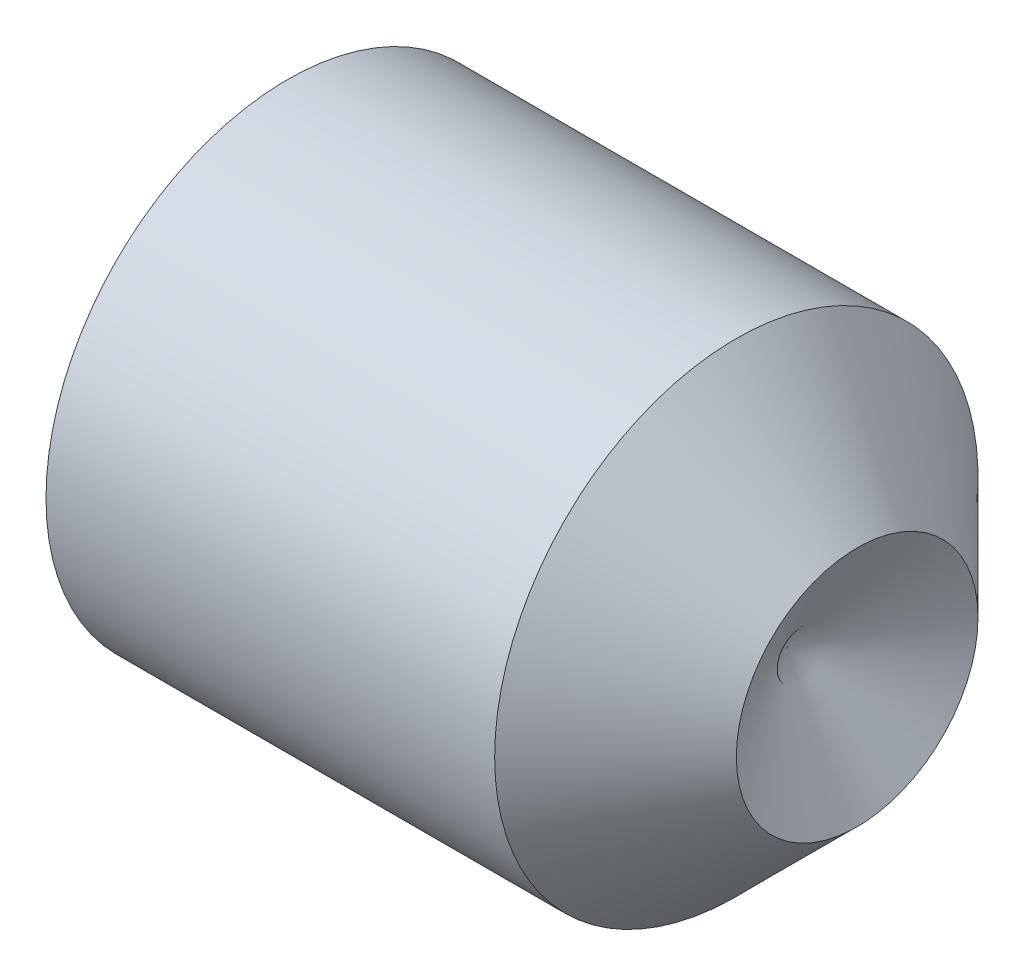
SolidWorks part; units mm, degrees
ref_plane "Front Plane" through (0, 0, 0) normal (0, 0, 1) x (1, 0, 0)
ref_plane "Top Plane" through (0, 0, 0) normal (0, 1, 0) x (1, 0, 0)
ref_plane "Right Plane" through (0, 0, 0) normal (1, 0, 0) x (0, 0, -1)
sketch "BodySke" plane through (0, 0, 0) normal (0, 0, 1) x (1, 0, 0)
  line L0 (0, 0) -> (3.28, 0) construction
  line L1 (2, 0) -> (2, 0.4)
  line L2 (2, 0.4) -> (1.6, 0.8)
  line L3 (1.6, 0.8) -> (0, 0.8)
  line L4 (0, 0.8) -> (0, 0)
  line L5 (0, 0) -> (2, 0)
  line L6 (1.65, 1.0236) -> (1.65, -0.6432) construction
  point P5 (0, 0.601)
  dimension "Diameter" = 1.6
  dimension "Length" = 2
  dimension "Chamfer_End" = 0.8
  dimension "Angle" = 135
  dimension "Minor_dia" = 1.202
  dimension "Advance" = 0.35
revolve "BaseBody" add sketch "BodySke" angle 360 about L0
sketch "HeadChamferSke" plane through (0, 0, 0) normal (0, 0, 1) x (1, 0, 0)
  line L0 (0, 0) -> (2.4505, 0) construction
  line L1 (0, 0.8) -> (0, 0.601)
  line L2 (0, 0.8) -> (0.1149, 0.8)
  line L3 (0.1149, 0.8) -> (0, 0.601)
  line L4 (1.6, 0.8) -> (0, 0.8) construction
  line L5 (0, 0.8) -> (0, -0.8) construction
  line L6 (0, 0.8) -> (0, 0) construction
  dimension "Angle" = 30
revolve "HeadChamfer" cut sketch "HeadChamferSke" angle 360 about L0
sketch "HexagonSocketSke" plane through (0, 0, 0) normal (-1, 0, 0) x (0, 0, 1)
  line L1 (0, 0.4041) -> (-0.35, 0.2021)
  line L2 (-0.35, 0.2021) -> (-0.35, -0.2021)
  line L3 (-0.35, -0.2021) -> (0, -0.4041)
  line L4 (0, -0.4041) -> (0.35, -0.2021)
  line L5 (0.35, -0.2021) -> (0.35, 0.2021)
  line L6 (0.35, 0.2021) -> (0, 0.4041)
  circle A0 centre (0, 0) radius 0.35 construction
  dimension "Hexagon_Width" = 0.7
extrude "HexagonSocket" cut sketch "HexagonSocketSke" against normal blind 0.7
sketch "CupPointSke" plane through (0, 0, 0) normal (0, 0, 1) x (1, 0, 0)
  line L0 (0, 0) -> (2.5104, 0) construction
  line L1 (2, 0.4) -> (2, 0)
  line L2 (2, 0) -> (1.7691, 0)
  line L3 (1.7691, 0) -> (2, 0.4)
  dimension "D1" = 60
revolve "CupPoint" cut sketch "CupPointSke" angle 360 about L0
sketch "ThdSchSke" plane through (0, 0, 0) normal (0, 0, 1) x (1, 0, 0)
  line L0 (0, 0) -> (2.6881, 0) construction
  line L1 (0.2351, 1.0298) -> (0.2351, 0.8)
  line L2 (0.2351, 1.0298) -> (0.4649, 1.0298)
  line L3 (0.4649, 1.0298) -> (0.4649, 0.8)
  line L4 (0.4649, 0.8) -> (0.35, 0.601)
  line L5 (0.35, 0.601) -> (0.2351, 0.8)
  line L6 (1.6, 0.8) -> (0.1149, 0.8) construction
  dimension "D1" = 0.35
revolve "ThreadSchematic" [suppressed] cut sketch "ThdSchSke" angle 360 about L0
pattern_linear "ThdSchPat" [suppressed] count 4 along (1, 0, 0)
equation "\"Minor_dia@ThreadCosmetic\" = \"Minor_dia@BodySke\""
equation "\"D1@ThdSchSke\" = \"Advance@BodySke\""
equation "\"Advance@ThdSchPat\" = \"Advance@BodySke\""
equation "\"D1@ThdSchPat\" =  int(  ( \"Length@BodySke\" -  ( \"Diameter@BodySke\" / 2 - \"Chamfer_End@BodySke\" / 2 )  )  / \"Advance@BodySke\" * 0.99 )"
